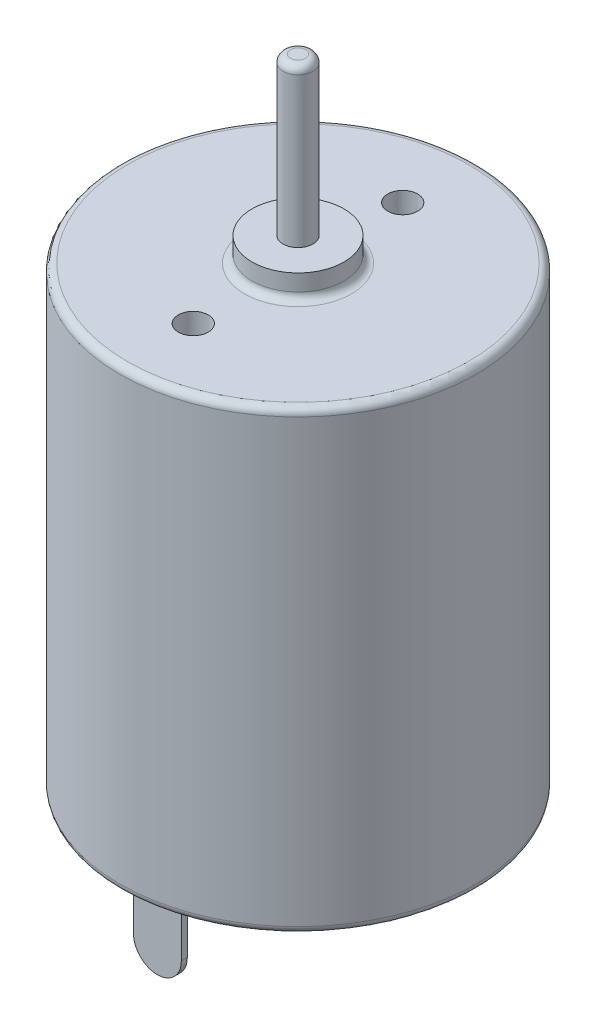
SolidWorks part; units mm, degrees
ref_plane "前基準面" through (0, 0, 0) normal (0, 0, 1) x (1, 0, 0)
ref_plane "上基準面" through (0, 0, 0) normal (0, 1, 0) x (1, 0, 0)
ref_plane "右基準面" through (0, 0, 0) normal (1, 0, 0) x (0, 0, -1)
sketch "草圖1" plane through (0, 0, 0) normal (0, 1, 0) x (1, 0, 0)
  circle A0 centre (0, 0) radius 11.9
  dimension "D1" = 23.8
extrude "填料-伸長1" add sketch "草圖1" along normal blind 30.5
sketch "草圖2" plane through (0, 0, 0) normal (0, -1, 0) x (1, 0, 0)
  line L0 (3.75, 2) -> (3.75, -2)
  circle A0 centre (0, 0) radius 4.25
  dimension "D1" = 8.5
  dimension "D2" = 3.75
extrude "填料-伸長2" add sketch "草圖2" along normal blind 1.5 contours L0 A0
sketch "草圖5" plane through (0, 0, 0) normal (0, -1, 0) x (1, 0, 0)
  line L0 (0, 9) -> (1.6, 9)
  line L1 (0, 9) -> (-1.6, 9)
  line L2 (-1.6, 9) -> (-1.6, 9.4)
  line L3 (-1.6, 9.4) -> (1.6, 9.4)
  line L4 (1.6, 9.4) -> (1.6, 9)
  line L5 (0, 0) -> (3.75, 0) construction
  line L6 (3.75, 2) -> (3.75, -2) construction
  line L7 (-1.6, -9.4) -> (1.6, -9.4)
  line L8 (-1.6, -9) -> (-1.6, -9.4)
  line L9 (0, -9) -> (-1.6, -9)
  line L10 (0, -9) -> (1.6, -9)
  line L11 (1.6, -9.4) -> (1.6, -9)
  circle A0 centre (0, 0) radius 9 construction
  point P8 (3.75, 0)
  dimension "D1" = 18
  dimension "D2" = 3.2
  dimension "D3" = 1.6
  dimension "D4" = 0.4
extrude "填料-伸長3" add sketch "草圖5" along normal blind 6
sketch "草圖6" plane through (0, 0, -9.4) normal (0, 0, -1) x (-1, 0, 0)
  line L2 (-1.6, -6) -> (1.6, -6) construction
  line L3 (-1.6, -6) -> (-1.6, 0) construction
  line L4 (-1.6, -4.4) -> (-1.6, -6)
  line L5 (-1.6, -6) -> (1.6, -6)
  line L6 (1.6, -6) -> (1.6, -4.4)
  arc A0 (-1.6, -4.4) -> (1.6, -4.4) centre (0, -4.4) ccw
extrude "除料-伸長1" cut sketch "草圖6" against normal through all contours A0 L5 M7 | A0 M5 M6
sketch "草圖7" plane through (0, 30.5, 0) normal (0, 1, 0) x (1, 0, 0)
  line L0 (0, 0) -> (11.9, 0) construction
  circle A0 centre (0, 7) radius 1
  circle A2 centre (0, 0) radius 11.9 construction
  circle A3 centre (0, -7) radius 1
  dimension "D1" = 2
  dimension "D2" = 7
extrude "除料-伸長2" cut sketch "草圖7" against normal blind 5
sketch "草圖8" plane through (0, 30.5, 0) normal (0, 1, 0) x (1, 0, 0)
  circle A0 centre (0, 0) radius 3.075
  dimension "D1" = 6.15
extrude "填料-伸長4" add sketch "草圖8" along normal blind 1.6
sketch "草圖9" plane through (0, 32.1, 0) normal (0, 1, 0) x (1, 0, 0)
  circle A0 centre (0, 0) radius 1
  dimension "D1" = 2
extrude "填料-伸長5" add sketch "草圖9" along normal blind 10.5
fillet "圓角1" radius 0.5 1 edges at (0, 30.5, 3.075)
fillet "圓角2" radius 0.5 2 edges at (0, 0, 11.9) (0, 30.5, 11.9)
fillet "圓角3" radius 0.5 1 edges at (0, 42.6, 1)
